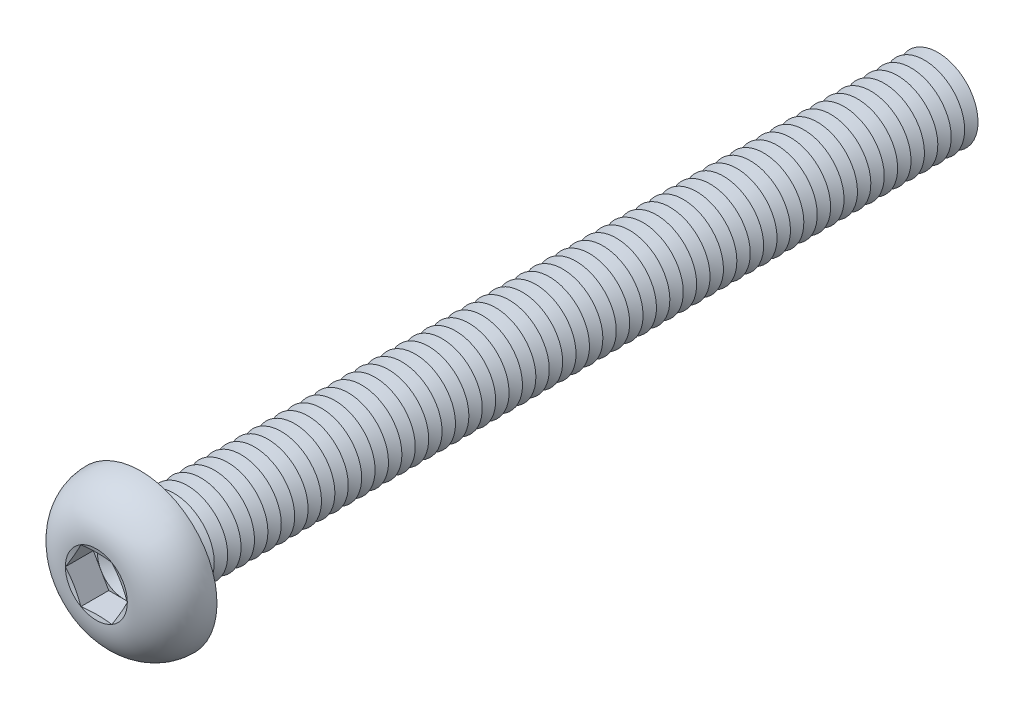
SolidWorks part; units mm, degrees
ref_plane "Front Plane" through (0, 0, 0) normal (0, 0, 1) x (1, 0, 0)
ref_plane "Top Plane" through (0, 0, 0) normal (0, 1, 0) x (1, 0, 0)
ref_plane "Right Plane" through (0, 0, 0) normal (1, 0, 0) x (0, 0, -1)
sketch "Sketch1" plane through (0, 0, 0) normal (1, 0, 0) x (0, 0, -1)
  line L0 (0, 1.5) -> (0, 2.85)
  line L3 (0, 1.5) -> (30, 1.5)
  line L4 (30, 1.5) -> (30, 0)
  line L5 (30, 0) -> (-1.65, 0) construction
  line L6 (-1.65, 0) -> (30, 0)
  line L7 (-1.65, 1.1547) -> (-1.65, 0.5773) construction
  line L8 (-1.65, 0.5773) -> (-1.65, 0)
  line L9 (-1.65, 1.1547) -> (-1.4953, 0.5773)
  line L10 (-1.4953, 0.5773) -> (-1.65, 0.5773)
  line L11 (30, 0) -> (22.7481, 0) construction
  line L12 (0, 2.85) -> (-1.65, 2.85) construction
  arc A1 (0, 2.85) -> (-1.65, 1.1547) centre (0, 1.1994) ccw
  point P8 (30, 0.75)
  dimension "D1" = 5.7
  dimension "D2" = 3
  dimension "D3" = 1.65
  dimension "D4" = 2.3094
  dimension "D5" = 30
  dimension "D6" = 15
revolve "Revolve1" add sketch "Sketch1" angle 360 about L5
fillet "Fillet1" radius 0.25 1 edges at (0, 1.5, 0)
sketch "Sketch2" plane through (0, 0, 0) normal (1, 0, 0) x (0, 0, -1)
  line L0 (29.75, 1.5) -> (30.25, 1.5)
  line L1 (30, 1.5) -> (0.25, 1.5) construction
  line L2 (30.25, 1.5) -> (30, 1.067)
  line L3 (30, -1.5) -> (30, 1.5) construction
  line L4 (30, 1.067) -> (29.75, 1.5)
  dimension "D1" = 0.5
revolve "Cut-Revolve1" cut sketch "Sketch2" angle 360 about axis through (0, 0, -30) along (0, 0, -1)
pattern_linear "LPattern1" count 60 spacing 0.5 along (0, 0, 1) of "Cut-Revolve1"
sketch "Sketch3" plane through (0, 0, 1.65) normal (0, 0, 1) x (1, 0, 0)
  line L7 (0.5773, 1) -> (-0.5774, 1)
  line L8 (-0.5774, 1) -> (-1.1547, 0)
  line L9 (-1.1547, 0) -> (-0.5773, -1)
  line L10 (-0.5773, -1) -> (0.5773, -1)
  line L11 (0.5773, -1) -> (1.1547, 0)
  line L12 (1.1547, 0) -> (0.5773, 1)
  circle A0 centre (0, 0) radius 1 construction
  circle A3 centre (0, 0) radius 1.1547 construction
extrude "Cut-Extrude1" cut sketch "Sketch3" against normal blind 1.04
sketch "Sketch4" plane through (0, 0, 0.61) normal (0, 0, 1) x (1, 0, 0)
  line L1 (0.5773, 1) -> (-0.5774, 1) construction
  circle A0 centre (0, 0) radius 1
extrude "Cut-Extrude2" cut sketch "Sketch4" against normal through all draft 60
